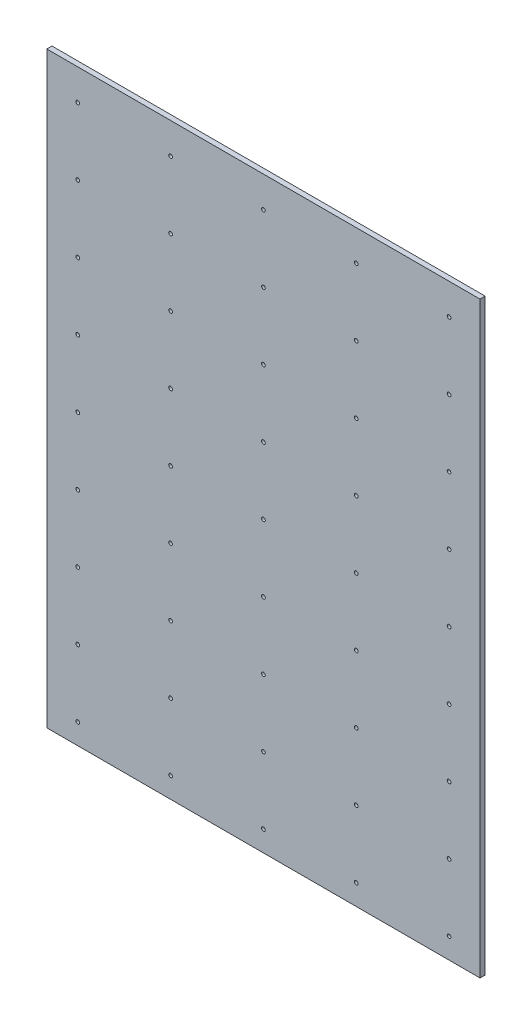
SolidWorks part; units mm, degrees
ref_plane "Piano frontale" through (0, 0, 0) normal (0, 0, 1) x (1, 0, 0)
ref_plane "Piano superiore" through (0, 0, 0) normal (0, 1, 0) x (1, 0, 0)
ref_plane "Piano destro" through (0, 0, 0) normal (1, 0, 0) x (0, 0, -1)
sketch "Schizzo1" plane through (0, 0, 0) normal (0, 0, 1) x (1, 0, 0)
  line L1 (-420, -570) -> (420, -570)
  line L2 (-420, -570) -> (-420, 570)
  line L3 (-420, 570) -> (420, 570)
  line L4 (420, -570) -> (420, 570)
  line L5 (-420, -570) -> (420, 570) construction
  line L6 (-420, 570) -> (420, -570) construction
  circle A0 centre (-360, 510) radius 3.6
  circle A1 centre (-360, 380) radius 3.6
  circle A2 centre (-360, 250) radius 3.6
  circle A3 centre (-360, 120) radius 3.6
  circle A4 centre (-360, -10) radius 3.6
  circle A5 centre (-360, -140) radius 3.6
  circle A6 centre (-360, -270) radius 3.6
  circle A7 centre (-360, -400) radius 3.6
  circle A8 centre (-360, -530) radius 3.6
  circle A9 centre (-180, 380) radius 3.6
  circle A10 centre (-180, 250) radius 3.6
  circle A11 centre (-180, 120) radius 3.6
  circle A12 centre (-180, -10) radius 3.6
  circle A13 centre (-180, -140) radius 3.6
  circle A14 centre (-180, -270) radius 3.6
  circle A15 centre (-180, -400) radius 3.6
  circle A16 centre (-180, -530) radius 3.6
  circle A17 centre (0, 380) radius 3.6
  circle A18 centre (0, 250) radius 3.6
  circle A19 centre (0, 120) radius 3.6
  circle A20 centre (0, -10) radius 3.6
  circle A21 centre (0, -140) radius 3.6
  circle A22 centre (0, -270) radius 3.6
  circle A23 centre (0, -400) radius 3.6
  circle A24 centre (0, -530) radius 3.6
  circle A25 centre (180, 380) radius 3.6
  circle A26 centre (180, 250) radius 3.6
  circle A27 centre (180, 120) radius 3.6
  circle A28 centre (180, -10) radius 3.6
  circle A29 centre (180, -140) radius 3.6
  circle A30 centre (180, -270) radius 3.6
  circle A31 centre (180, -400) radius 3.6
  circle A32 centre (180, -530) radius 3.6
  circle A33 centre (360, 380) radius 3.6
  circle A34 centre (360, 250) radius 3.6
  circle A35 centre (360, 120) radius 3.6
  circle A36 centre (360, -10) radius 3.6
  circle A37 centre (360, -140) radius 3.6
  circle A38 centre (360, -270) radius 3.6
  circle A39 centre (360, -400) radius 3.6
  circle A40 centre (360, -530) radius 3.6
  circle A41 centre (-180, 510) radius 3.6
  circle A42 centre (0, 510) radius 3.6
  circle A43 centre (180, 510) radius 3.6
  circle A44 centre (360, 510) radius 3.6
  point P0 (0, 0)
  dimension "D3" = 7.2
  dimension "D1" = 840
  dimension "D2" = 1140
  dimension "D4" = 60
  dimension "D5" = 60
  dimension "D6" = 9
extrude "Estrusione-Estrusione1" add sketch "Schizzo1" along normal blind 10
